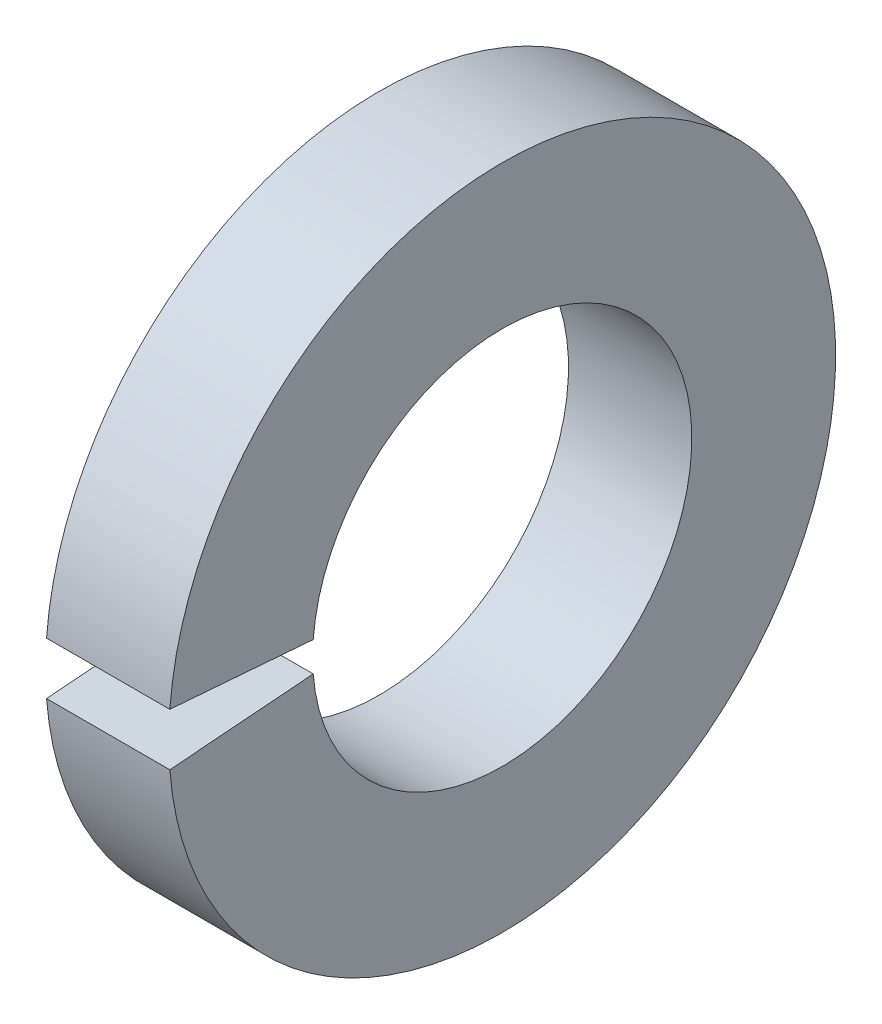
SolidWorks part; units mm, degrees
ref_plane "Plane1" through (0, 0, 0) normal (0, 0, 1) x (1, 0, 0)
ref_plane "Plane2" through (0, 0, 0) normal (0, 1, 0) x (1, 0, 0)
ref_plane "Plane3" through (0, 0, 0) normal (1, 0, 0) x (0, 0, -1)
sketch "Sketch1" plane through (0, 0, 0) normal (0, 0, 1) x (1, 0, 0)
  line L0 (-34.925, 0) -> (9.525, 0) construction
  line L1 (0, 12.8905) -> (0, 22.6695)
  line L2 (0, 22.6695) -> (-8.382, 22.6695)
  line L3 (-8.382, 22.6695) -> (-8.382, 12.8905)
  line L4 (-8.382, 12.8905) -> (0, 12.8905)
  dimension "Thickness" = 8.382
  dimension "Inside_dia" = 25.781
  dimension "Outside_dia" = 45.339
revolve "Base-Revolve" add sketch "Sketch1" angle 360 about L0
sketch "Sketch2" plane through (0, 0, 0) normal (-1, 0, 0) x (0, -1, 0)
  line L0 (0, 0) -> (1.8142, 23.0516)
  line L1 (0, -3.175) -> (0, 12.7) construction
  line L2 (0, 0) -> (-1.8142, 23.0516)
  arc A0 (1.8142, 23.0516) -> (-1.8142, 23.0516) centre (0, 0) ccw
  dimension "D1" = 23.1229
  dimension "Gap_ang" = 9
extrude "Gap" cut sketch "Sketch2" along normal through all
equation "\"D1@Sketch2\" = \"Outside_dia@Sketch1\" * 0.51"
